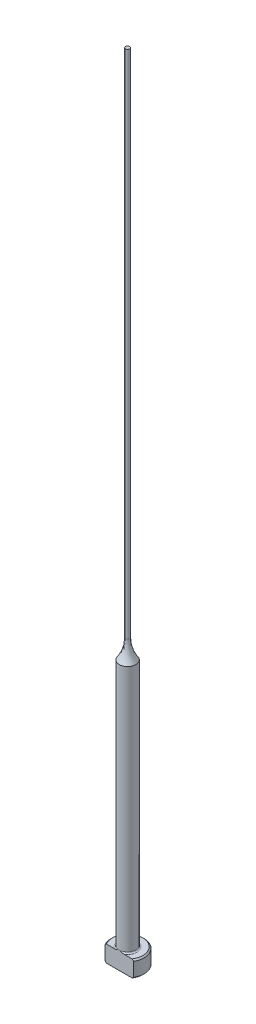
SolidWorks part; units mm, degrees
ref_plane "Front Plane" through (0, 0, 0) normal (0, 0, 1) x (1, 0, 0)
ref_plane "Top Plane" through (0, 0, 0) normal (0, 1, 0) x (1, 0, 0)
ref_plane "Right Plane" through (0, 0, 0) normal (1, 0, 0) x (0, 0, -1)
sketch "Sketch1" plane through (0, 0, 0) normal (0, 0, 1) x (1, 0, 0)
  line L0 (0, 259.9588) -> (0, -15.1925) construction
  line L1 (0, 0) -> (-3.175, 0)
  line L2 (-3.175, 0) -> (-3.175, 3.175)
  line L3 (-3.175, 3.175) -> (-1.5875, 3.175)
  line L4 (-0.3962, 54.5027) -> (-0.3962, 152.4)
  line L5 (-0.3962, 152.4) -> (0, 152.4)
  line L6 (0, 152.4) -> (0, 0)
  line L7 (-1.5875, 3.175) -> (-1.5875, 50.8)
  arc A0 (-1.5875, 50.8) -> (-0.3962, 54.5027) centre (-6.7462, 54.5027) ccw
  point P13 (-1.5875, 0)
  dimension "D1" = 6.35
  dimension "L" = 152.4
  dimension "D2" = 3.175
  dimension "H" = 6.35
  dimension "T" = 3.175
  dimension "D" = 0.7925
  dimension "S" = 50.8
revolve "Revolve1" add sketch "Sketch1" angle 360 about L0
chamfer "Chamfer1" distance 0.254 angle 45 2 edges at (0, 3.175, 3.175) (0, 0, 3.175)
fillet "Fillet1" radius 0.254 1 edges at (0, 3.175, 1.5875)
sketch "Sketch2" plane through (0, 0, 0) normal (0, -1, 0) x (1, 0, 0)
  line L0 (-2.7496, 1.5875) -> (2.7496, 1.5875)
  circle A0 centre (0, 0) radius 3.175 construction
  arc A1 (2.7496, 1.5875) -> (-2.7496, 1.5875) centre (0, 0) ccw
  circle A4 centre (0, 0) radius 1.5875 construction
  dimension "D1" = 0
extrude "KEY" cut sketch "Sketch2" against normal through all
